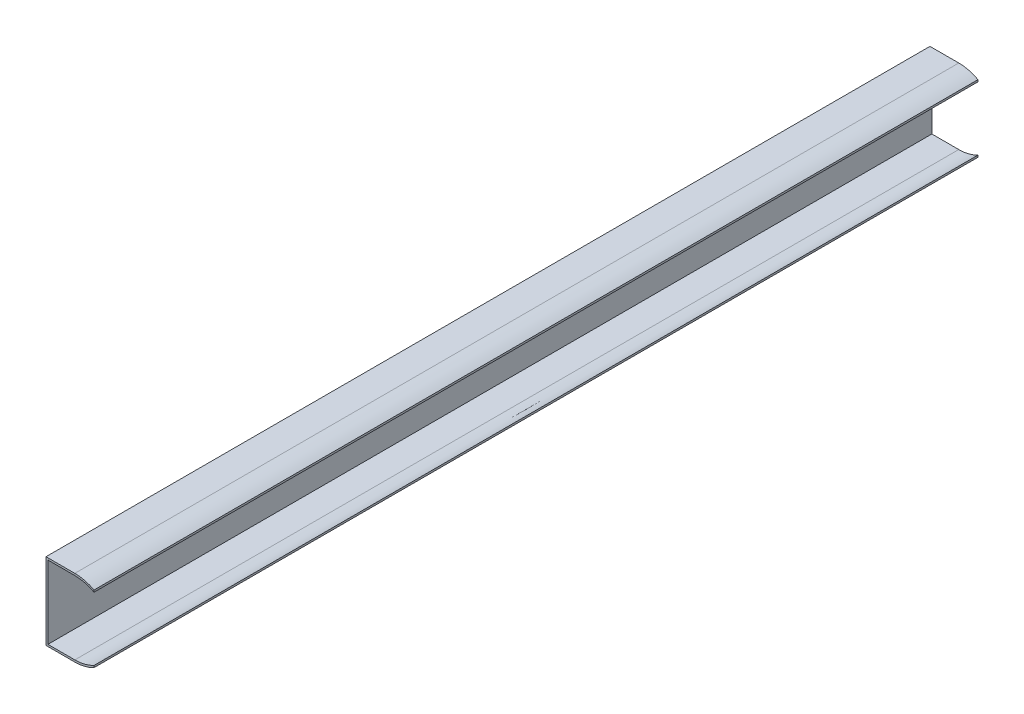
SolidWorks part; units mm, degrees
ref_plane "Plan de face" through (0, 0, 0) normal (0, 0, 1) x (1, 0, 0)
ref_plane "Plan de dessus" through (0, 0, 0) normal (0, 1, 0) x (1, 0, 0)
ref_plane "Plan de droite" through (0, 0, 0) normal (1, 0, 0) x (0, 0, -1)
sketch "Esquisse1" plane through (0, 0, 0) normal (0, 0, 1) x (1, 0, 0)
  line L0 (0, 0) -> (0, 80)
  line L1 (0, 80) -> (30, 80)
  line L2 (0, 40) -> (81.0721, 40) construction
  line L3 (2, 78) -> (2, 2)
  line L4 (0, 0) -> (30, 0)
  line L5 (2, 78) -> (30, 78)
  line L6 (50, 75) -> (50, 73)
  line L7 (50, 5) -> (50, 7)
  line L8 (2, 2) -> (30, 2)
  spline S0 degree 2 poles (30, 80) (40.6033, 79.9515) (50, 75) knots 0 0 0 1 1 1
  spline S1 degree 2 poles (30, 0) (40.6033, 0.0485) (50, 5) knots 0 0 0 1 1 1
  spline S2 degree 2 poles (30, 78) (40.6033, 77.9515) (50, 73) knots 0 0 0 1 1 1
  spline S3 degree 2 poles (30, 2) (40.6033, 2.0485) (50, 7) knots 0 0 0 1 1 1
  point P20 (2, 40)
  dimension "D1" = 80
  dimension "D2" = 30
  dimension "D3" = 5
  dimension "D4" = 50
  dimension "D5" = 1.2
  dimension "D6" = 10
  dimension "D7" = 5
  dimension "D8" = 10
  dimension "D9" = 1.2
  dimension "D10" = 28
  dimension "D11" = 20
  dimension "D12" = 2
  dimension "D13" = 2
extrude "Extrusion1" add sketch "Esquisse1" along normal blind 920
